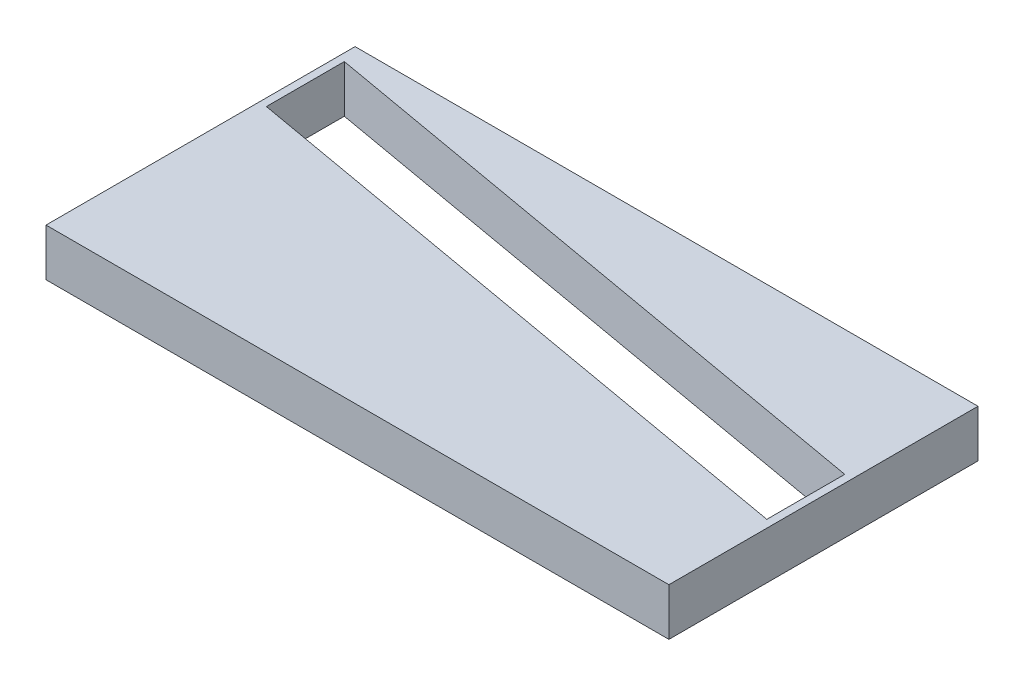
SolidWorks part; units mm, degrees
ref_plane "Front" through (0, 0, 0) normal (0, 0, 1) x (1, 0, 0)
ref_plane "Top" through (0, 0, 0) normal (0, 1, 0) x (1, 0, 0)
ref_plane "Right" through (0, 0, 0) normal (1, 0, 0) x (0, 0, -1)
sketch "Sketch1" plane through (0, 0, 0) normal (0, 1, 0) x (1, 0, 0)
  line L1 (-668.02, 331.47) -> (668.02, 331.47)
  line L2 (-668.02, 331.47) -> (-668.02, -331.47)
  line L3 (-668.02, -331.47) -> (668.02, -331.47)
  line L4 (668.02, 331.47) -> (668.02, -331.47)
  line L5 (-668.02, 331.47) -> (668.02, -331.47) construction
  line L6 (-668.02, -331.47) -> (668.02, 331.47) construction
  point P0 (0, 0)
  dimension "D1" = 662.94
  dimension "D2" = 1336.04
extrude "Extrude1" add sketch "Sketch1" along normal mid plane 101.6
sketch "Sketch2" plane through (0, 50.8, 0) normal (0, 1, 0) x (1, 0, 0)
  line L0 (-646.6912, 286.0688) -> (646.5082, 57.8231) construction
  line L1 (-646.6912, 286.0688) -> (646.5082, 57.8231) construction
  line L2 (-646.7189, 129.2548) -> (646.4804, -98.9909) construction
  line L3 (-646.7189, 129.2548) -> (646.4804, -98.9909) construction
  line L4 (646.4804, -98.9909) -> (646.5082, 57.8231) construction
  line L5 (-646.7189, 129.2548) -> (-646.6912, 286.0688) construction
  line L9 (-651.7701, 292.1238) -> (651.589, 62.0849)
  line L10 (651.5594, -105.0458) -> (651.589, 62.0849)
  line L11 (-651.7997, 124.993) -> (651.5594, -105.0458)
  line L12 (-651.7997, 124.993) -> (-651.7701, 292.1238)
  dimension "D1" = 5.08
extrude "Cut-Extrude1" cut sketch "Sketch2" against normal through all
